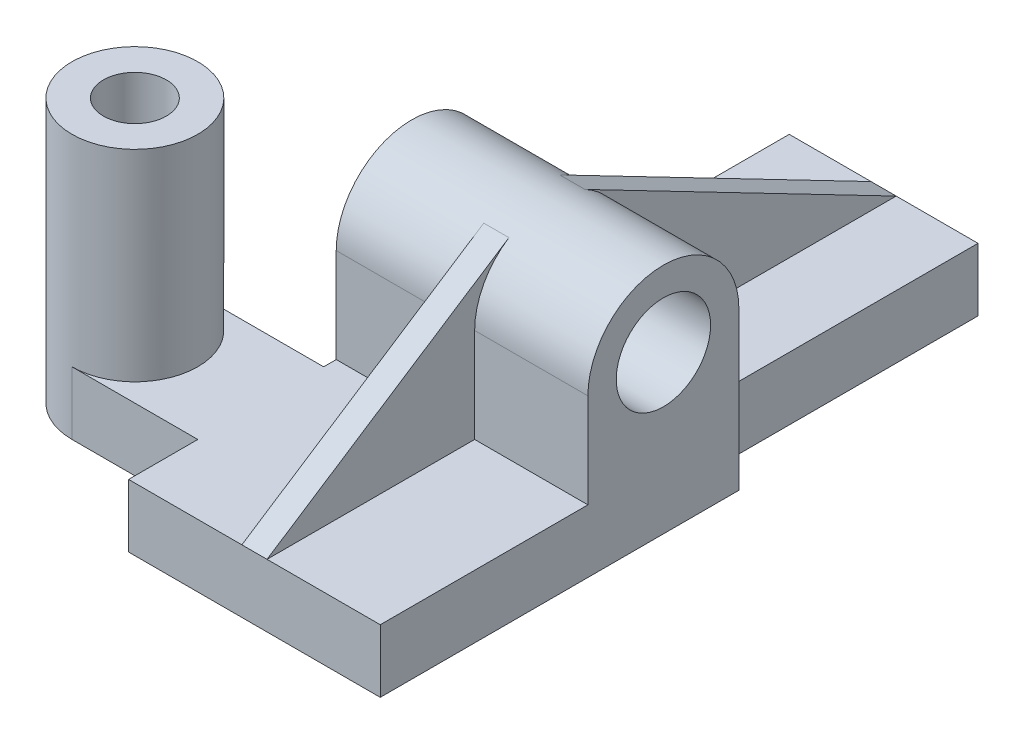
SolidWorks part; units mm, degrees
ref_plane "Front Plane" through (0, 0, 0) normal (0, 0, 1) x (1, 0, 0)
ref_plane "Top Plane" through (0, 0, 0) normal (0, 1, 0) x (1, 0, 0)
ref_plane "Right Plane" through (0, 0, 0) normal (1, 0, 0) x (0, 0, -1)
sketch "Sketch1" plane through (0, 0, 0) normal (0, 1, 0) x (1, 0, 0)
  line L0 (0, 100) -> (0, 0) construction
  line L1 (-20, 0) -> (20, 0)
  line L2 (-20, 0) -> (-20, 57)
  line L3 (-20, 57) -> (-15, 57)
  line L4 (20, 0) -> (20, 57)
  line L6 (-15, 57) -> (-15, 100)
  line L7 (-15, 100) -> (15, 100)
  line L8 (15, 57) -> (15, 100)
  line L9 (15, 57) -> (20, 57)
  dimension "D1" = 100
  dimension "D2" = 57
  dimension "D3" = 40
  dimension "D4" = 30
extrude "Extrude1" add sketch "Sketch1" along normal blind 10
sketch "Sketch2" plane through (20, 0, 0) normal (1, 0, 0) x (0, 0, -1)
  line L0 (57, 10) -> (57, 25)
  line L1 (33, 10) -> (33, 25)
  line L3 (0, 10) -> (57, 10) construction
  line L8 (33, 10) -> (57, 10)
  line L10 (0, 0) -> (57, 0) construction
  arc A0 (33, 25) -> (57, 25) centre (45, 25) cw
  dimension "D1" = 12
  dimension "D2" = 25
extrude "Extrude2" add sketch "Sketch2" against normal up to vertex (40 mm away)
sketch "Sketch5" plane through (0, 0, 0) normal (0, 1, 0) x (1, 0, 0)
  line L0 (-20, 33) -> (-20, 0) construction
  line L1 (-20, 11) -> (-40, 11)
  line L2 (-20, 11) -> (-20, 31)
  line L3 (-20, 31) -> (-40, 31)
  line L4 (20, 0) -> (20, 33) construction
  line L5 (-20, 0) -> (20, 0) construction
  arc A0 (-40, 31) -> (-40, 11) centre (-40, 21) ccw
  dimension "D1" = 21
  dimension "D3" = 20
  dimension "D2" = 60
extrude "Extrude3" add sketch "Sketch5" along normal up to vertex (10 mm away)
sketch "Sketch6" plane through (0, 0, 0) normal (0, 1, 0) x (1, 0, 0)
  circle A0 centre (-40, 21) radius 10
  arc A1 (-40, 31) -> (-40, 11) centre (-40, 21) ccw construction
extrude "Extrude4" add sketch "Sketch6" along normal blind 42
sketch "Sketch3" plane through (0, 0, 0) normal (1, 0, 0) x (0, 0, -1)
  line L0 (0, 10) -> (38.4487, 35.0539)
  line L1 (100, 10) -> (50.5236, 35.6532) construction
  arc A0 (57, 25) -> (33, 25) centre (45, 25) ccw construction
rib "Rib3" sketch "Sketch3" sketch "Sketch3" thickness 4 extrusion direction parallel to sketch draft on no parameters "D1"=4
sketch "Sketch4" plane through (0, 0, 0) normal (1, 0, 0) x (0, 0, -1)
  line L0 (100, 10) -> (50.5236, 35.6532) construction
  line L1 (100, 10) -> (50.5236, 35.6532)
rib "Rib4" sketch "Sketch4" sketch "Sketch4" thickness 4 extrusion direction parallel to sketch draft on no parameters "D1"=4
hole_wizard "Ø10.0 (10) Diameter Hole1" positions "Sketch8" profile "Sketch7" hole size "Ø10.0" standard "Ansi Metric"
sketch "Sketch8" plane through (0, 42, 0) normal (0, 1, 0) x (-1, 0, 0)
  point P0 (40, -21)
sketch "Sketch7" plane through (-40, 42, -21) normal (1, 0, 0) x (0, 0, 1)
  line L0 (0, 0) -> (0, 42.0001)
  line L1 (0, 42.0001) -> (5, 42.0001)
  line L2 (5, 42.0001) -> (5, 0)
  line L5 (5, 0) -> (0, 0)
  line L11 (0, -6.35) -> (0, 107.95) construction
  dimension "Thru Hole Dia." = 10
  dimension "Thru Hole Depth" = 42.0001
hole_wizard "Ø15.0 (15) Diameter Hole1" positions "Sketch9" profile "Sketch10" hole size "Ø15.0" standard "Ansi Metric"
sketch "Sketch9" plane through (20, 0, 0) normal (1, 0, 0) x (0, 1, 0)
  arc A0 (25, -57) -> (25, -33) centre (25, -45) ccw construction
  point P0 (25, -45)
sketch "Sketch10" plane through (20, 25, -45) normal (0, 1, 0) x (0, 0, -1)
  line L0 (0, 0) -> (0, 70)
  line L1 (0, 70) -> (7.5, 70)
  line L2 (7.5, 70) -> (7.5, 0)
  line L5 (7.5, 0) -> (0, 0)
  line L11 (0, -6.35) -> (0, 107.95) construction
  dimension "Thru Hole Dia." = 15
  dimension "Thru Hole Depth" = 70
